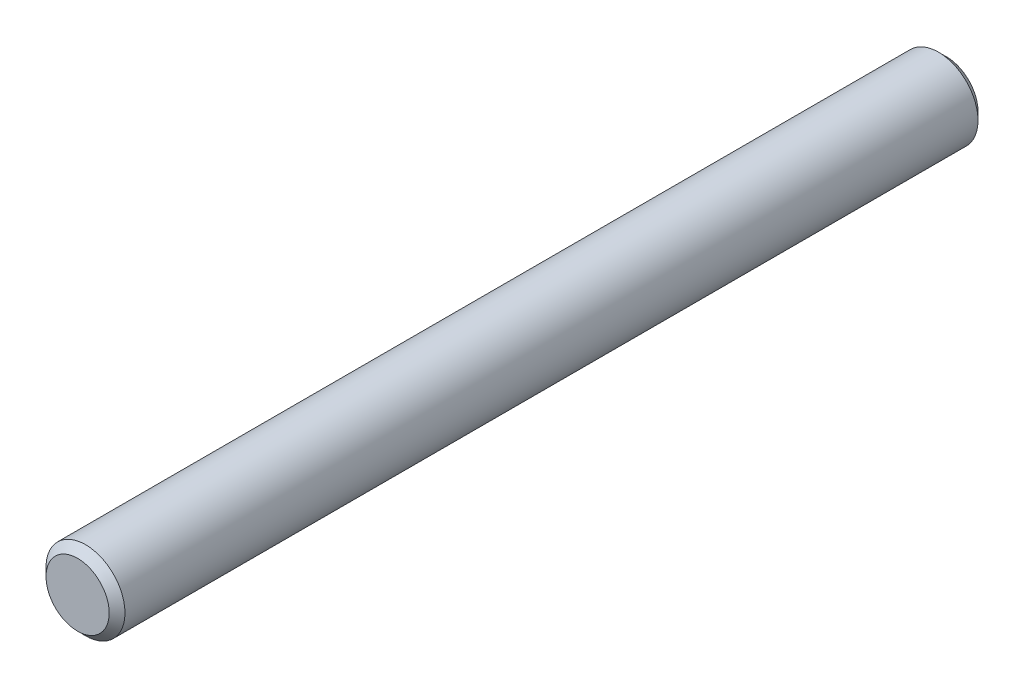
SolidWorks part; units mm, degrees
ref_plane "Plan1" through (0, 0, 0) normal (0, 0, 1) x (1, 0, 0)
ref_plane "plan2" through (0, 0, 0) normal (0, 1, 0) x (1, 0, 0)
ref_plane "Plan3" through (0, 0, 0) normal (1, 0, 0) x (0, 0, -1)
sketch "Esquisse1" plane through (0, 0, 0) normal (0, 0, 1) x (1, 0, 0)
  circle A0 centre (0, 0) radius 5
  dimension "D1" = 10
extrude "Base-Extrusion" add sketch "Esquisse1" along normal blind 110
chamfer "Chanfrein1" distance 1 angle 45
